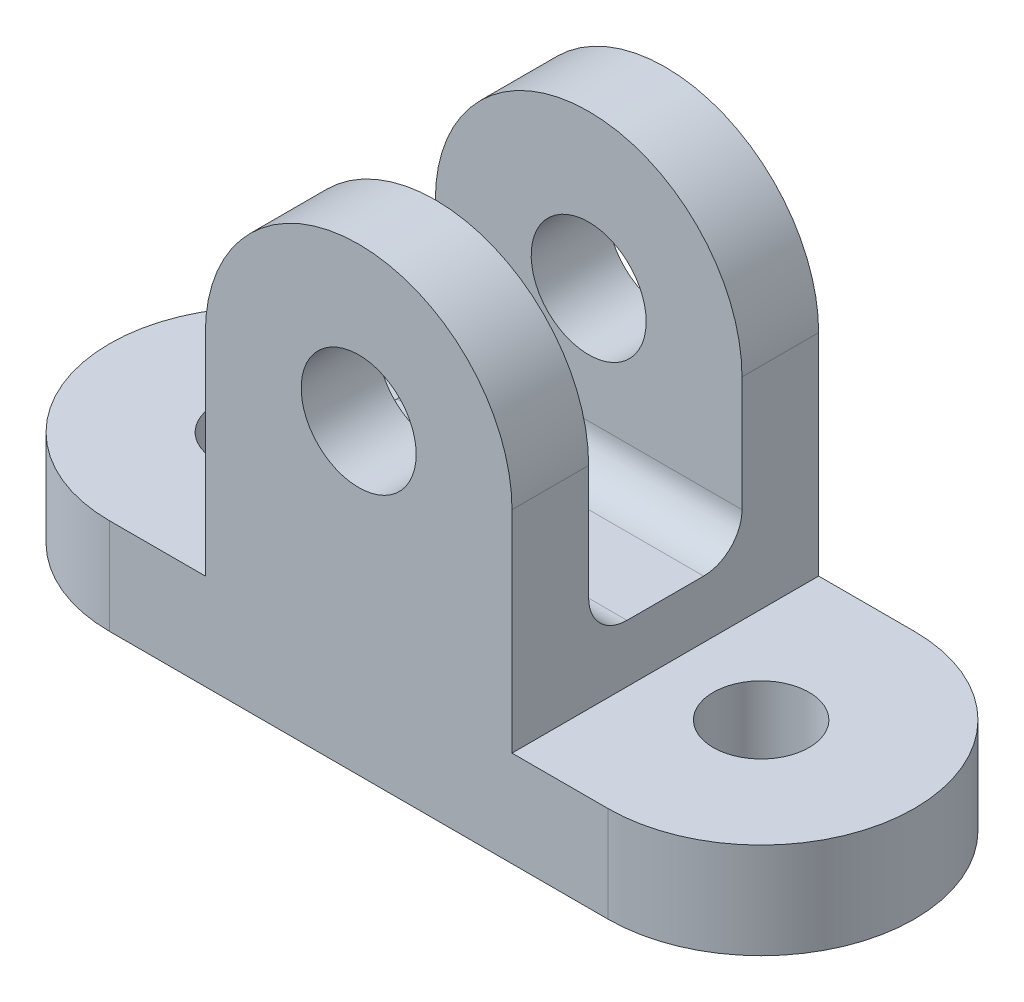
SolidWorks part; units mm, degrees
ref_plane "Alzado" through (0, 0, 0) normal (0, 0, 1) x (1, 0, 0)
ref_plane "Planta" through (0, 0, 0) normal (0, 1, 0) x (1, 0, 0)
ref_plane "Vista lateral" through (0, 0, 0) normal (1, 0, 0) x (0, 0, -1)
sketch "Croquis1" plane through (0, 0, 0) normal (0, 1, 0) x (1, 0, 0)
  line L0 (-13, 0) -> (13, 0) construction
  line L1 (-13, 8) -> (13, 8)
  line L2 (-13, -8) -> (13, -8)
  arc A0 (-13, 8) -> (-13, -8) centre (-13, 0) ccw
  arc A1 (13, -8) -> (13, 8) centre (13, 0) ccw
  point P2 (0, 0)
  dimension "D1" = 8
  dimension "D2" = 26
extrude "Saliente-Extruir1" add sketch "Croquis1" along normal blind 5
sketch "Croquis2" plane through (0, 0, 8) normal (0, 0, 1) x (1, 0, 0)
  line L0 (-8, 5) -> (-8, 16)
  line L1 (-13, 5) -> (13, 5) construction
  line L2 (8, 16) -> (8, 5)
  line L3 (8, 5) -> (-8, 5)
  line L4 (0, 16) -> (0, 0) construction
  line L5 (-13, 0) -> (13, 0) construction
  arc A0 (-8, 16) -> (8, 16) centre (0, 16) cw
  dimension "D1" = 8
  dimension "D2" = 16
extrude "Saliente-Extruir2" add sketch "Croquis2" against normal up to surface (16 mm away)
sketch "Croquis3" plane through (8, 0, 0) normal (1, 0, 0) x (0, 0, -1)
  line L0 (8, 24) -> (-8, 24) construction
  line L1 (-4, 24) -> (4, 24)
  line L2 (-4, 24) -> (-4, 8)
  line L3 (-4, 8) -> (4, 8)
  line L4 (4, 24) -> (4, 8)
  line L5 (0, 8) -> (0, 0) construction
  line L6 (8, 5) -> (-8, 5) construction
  line L7 (-8, 5) -> (-8, 16) construction
  dimension "D1" = 3
  dimension "D2" = 4
extrude "Cortar-Extruir1" cut sketch "Croquis3" against normal through all
sketch "Croquis4" plane through (0, 5, 0) normal (0, 1, 0) x (1, 0, 0)
  circle A0 centre (-13, 0) radius 2.5
  circle A1 centre (13, 0) radius 2.5
  dimension "D1" = 5
extrude "Cortar-Extruir2" cut sketch "Croquis4" against normal through all
sketch "Croquis5" plane through (0, 0, 8) normal (0, 0, 1) x (1, 0, 0)
  circle A0 centre (0, 16) radius 3
  dimension "D1" = 6
extrude "Cortar-Extruir3" cut sketch "Croquis5" against normal through all
fillet "Redondeo1" radius 2 2 edges at (0, 8, 4) (0, 8, -4)
